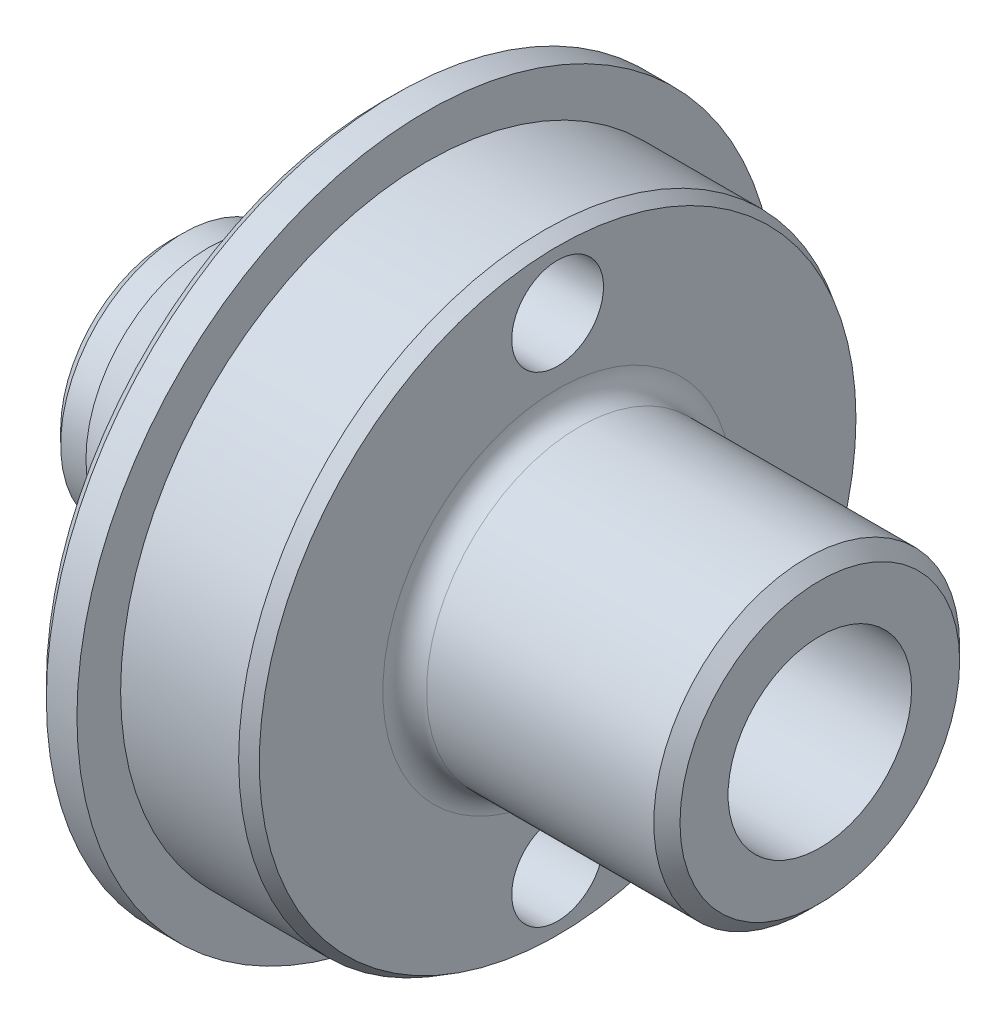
SolidWorks part; units mm, degrees
ref_plane "Plan de face" through (0, 0, 0) normal (0, 0, 1) x (1, 0, 0)
ref_plane "Plan de dessus" through (0, 0, 0) normal (0, 1, 0) x (1, 0, 0)
ref_plane "Plan de droite" through (0, 0, 0) normal (1, 0, 0) x (0, 0, -1)
sketch "Esquisse1" plane through (0, 0, 0) normal (0, 0, 1) x (1, 0, 0)
  line L0 (5, 8) -> (5, 0)
  line L1 (5, 0) -> (6, 0)
  line L2 (6, 0) -> (6, 8)
  line L3 (6, 8) -> (5, 8)
  line L4 (5, 0) -> (6, 0) construction
revolve "Révolution1" add sketch "Esquisse1" angle 360 about L4
sketch "Esquisse2" plane through (6, 0, 0) normal (1, 0, 0) x (0, 0, -1)
  circle A0 centre (0, 0) radius 7
extrude "Boss.-Extru.1" add sketch "Esquisse2" along normal blind 3
sketch "Esquisse3" plane through (9, 0, 0) normal (1, 0, 0) x (0, 0, -1)
  circle A0 centre (0, 0) radius 3.5
extrude "Boss.-Extru.2" add sketch "Esquisse3" along normal blind 6
sketch "Esquisse4" plane through (5, 0, 0) normal (-1, 0, 0) x (0, 0, 1)
  circle A0 centre (0, 0) radius 4.25
  dimension "D1" = 8.5
extrude "Boss.-Extru.3" add sketch "Esquisse4" along normal blind 4 draft 20
sketch "Esquisse5" plane through (1, 0, 0) normal (-1, 0, 0) x (0, 0, 1)
  circle A0 centre (0, 0) radius 2.7941
  circle A1 centre (0, 0) radius 2.7941 construction
extrude "Boss.-Extru.4" add sketch "Esquisse5" along normal blind 0.8788
sketch "Esquisse6" plane through (0, 0, 0) normal (0, 0, 1) x (1, 0, 0)
  line L0 (0, 1.5) -> (0, 0)
  line L1 (0, 0) -> (15, 0)
  line L2 (15, -3.5) -> (15, 3.5) construction
  line L3 (15, 0.75) -> (15, 0)
  line L5 (15, 0.75) -> (5.5, 0.75)
  line L6 (5.5, 0.75) -> (5.5, 1.5)
  line L7 (5.5, 1.5) -> (0, 1.5)
  line L8 (0, 0) -> (15, 0) construction
  line L10 (0, 0) -> (-5.1872, 0) construction
  dimension "D1" = 0.75
  dimension "D5" = 1.5
  dimension "D6" = 5.5
revolve "Enlèvement de matière-Révolution1" cut sketch "Esquisse6" angle 360 about L8
hole_wizard "Perçage1" positions "Esquisse8" profile "Esquisse7" legacy
sketch "Esquisse8" plane through (9, 0, 0) normal (1, 0, 0) x (0, 0, -1)
  point P0 (0, -5.5)
sketch "Esquisse7" plane through (9, -5.5, 0) normal (0, 1, 0) x (0, 0, -1)
  line L0 (0, 0) -> (0, 4)
  line L1 (0, 4) -> (1.05, 4)
  line L2 (1.05, 4) -> (1.05, 0)
  line L3 (1.05, 0) -> (0, 0)
  line L4 (0, 110) -> (0, -10) construction
  dimension "Diamètre" = 2.1
  dimension "Profondeur" = 4
hole_wizard "Perçage2" positions "Esquisse10" profile "Esquisse9" legacy
sketch "Esquisse10" plane through (9, 0, 0) normal (1, 0, 0) x (0, 0, -1)
  point P0 (0, 5.5)
sketch "Esquisse9" plane through (9, 5.5, 0) normal (0, 1, 0) x (0, 0, -1)
  line L0 (0, 0) -> (0, 4)
  line L1 (0, 4) -> (1.05, 4)
  line L2 (1.05, 4) -> (1.05, 0)
  line L3 (1.05, 0) -> (0, 0)
  line L4 (0, 110) -> (0, -10) construction
  dimension "Diamètre" = 2.1
  dimension "Profondeur" = 4
hole_wizard "Trou taraudé M51" positions "Esquisse12" profile "Esquisse11" tap size "M5" standard "ISO"
sketch "Esquisse12" plane through (15, 0, 0) normal (1, 0, 0) x (0, 0, -1)
  point P0 (0, 0)
sketch "Esquisse11" plane through (15, 0, 0) normal (0, 1, 0) x (0, 0, -1)
  line L0 (0, 0) -> (0, 8.7618)
  line L1 (0, 8.7618) -> (2.1, 7.5)
  line L2 (2.1, 7.5) -> (2.1, 0)
  line L5 (2.1, 0) -> (0, 0)
  line L10 (0, 8.7618) -> (-2.1, 7.5) construction
  line L11 (0, -6.35) -> (0, 107.95) construction
  dimension "Diamètre du trou pour taraudage" = 4.2
  dimension "Profondeur du trou pour taraudage" = 7.5
  dimension "Angle de pointe" = 118
chamfer "Chanfrein1" distance 0.3 angle 30 1 edges at (9, 0, -7)
fillet "Congé1" radius 0.5 1 edges at (9, 0, -3.5)
chamfer "Chanfrein3" distance 0.3 angle 45 1 edges at (15, 0, -3.5)
chamfer "Chanfrein4" distance 0.3 angle 45 2 edges at (0.1212, 0, 2.7941) (5, 0, -8)
